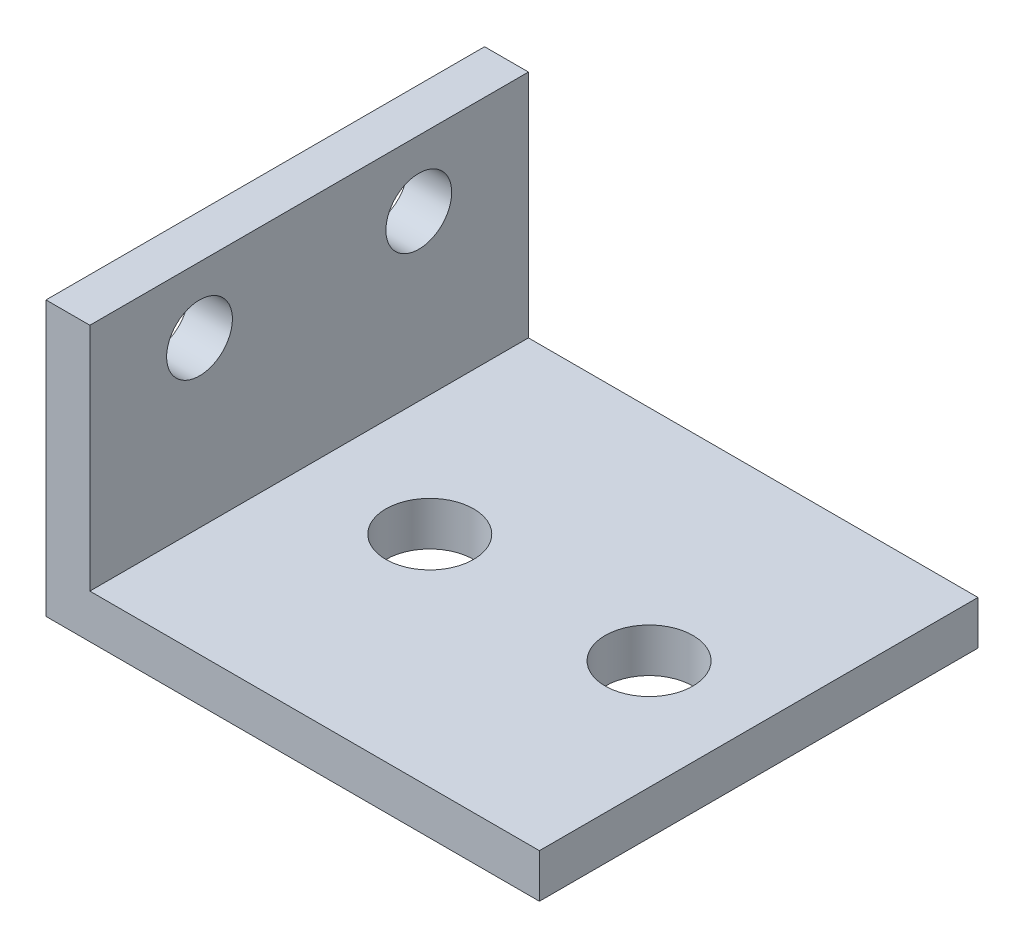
SolidWorks part; units mm, degrees
ref_plane "Plan de face" through (0, 0, 0) normal (0, 0, 1) x (1, 0, 0)
ref_plane "Plan de dessus" through (0, 0, 0) normal (0, 1, 0) x (1, 0, 0)
ref_plane "Plan de droite" through (0, 0, 0) normal (1, 0, 0) x (0, 0, -1)
sketch "Esquisse1" plane through (0, 0, 0) normal (0, 0, 1) x (1, 0, 0)
  line L0 (0, 0) -> (0, 25)
  line L1 (0, 25) -> (4, 25)
  line L2 (4, 25) -> (4, 4)
  line L3 (4, 4) -> (45, 4)
  line L4 (45, 4) -> (45, 0)
  line L5 (45, 0) -> (0, 0)
  dimension "D1" = 4
  dimension "D2" = 4
  dimension "D3" = 45
  dimension "D4" = 25
extrude "Boss.-Extru.1" add sketch "Esquisse1" along normal blind 40
sketch "Esquisse2" plane through (4, 0, 0) normal (1, 0, 0) x (0, 0, -1)
  line L0 (-40, 25) -> (0, 25) construction
  line L1 (-40, 25) -> (-40, 0) construction
  line L2 (0, 4) -> (0, 25) construction
  circle A0 centre (-30, 19) radius 3
  circle A1 centre (-10, 19) radius 3
  point P6 (-40, 12.5)
  dimension "D1" = 6
  dimension "D2" = 6
  dimension "D4" = 6
  dimension "D5" = 10
  dimension "D6" = 10
  dimension "D3" = 6
extrude "Enlèv. mat.-Extru.1" cut sketch "Esquisse2" against normal blind 40
sketch "Esquisse3" plane through (0, 4, 0) normal (0, 1, 0) x (1, 0, 0)
  line L0 (45, -40) -> (45, 0) construction
  line L1 (45, 0) -> (4, 0) construction
  circle A0 centre (15, -20) radius 4
  circle A1 centre (35, -20) radius 4
  dimension "D1" = 8
  dimension "D2" = 8
  dimension "D3" = 20
  dimension "D4" = 10
  dimension "D5" = 20
  dimension "D6" = 20
extrude "Enlèv. mat.-Extru.2" cut sketch "Esquisse3" against normal blind 40
